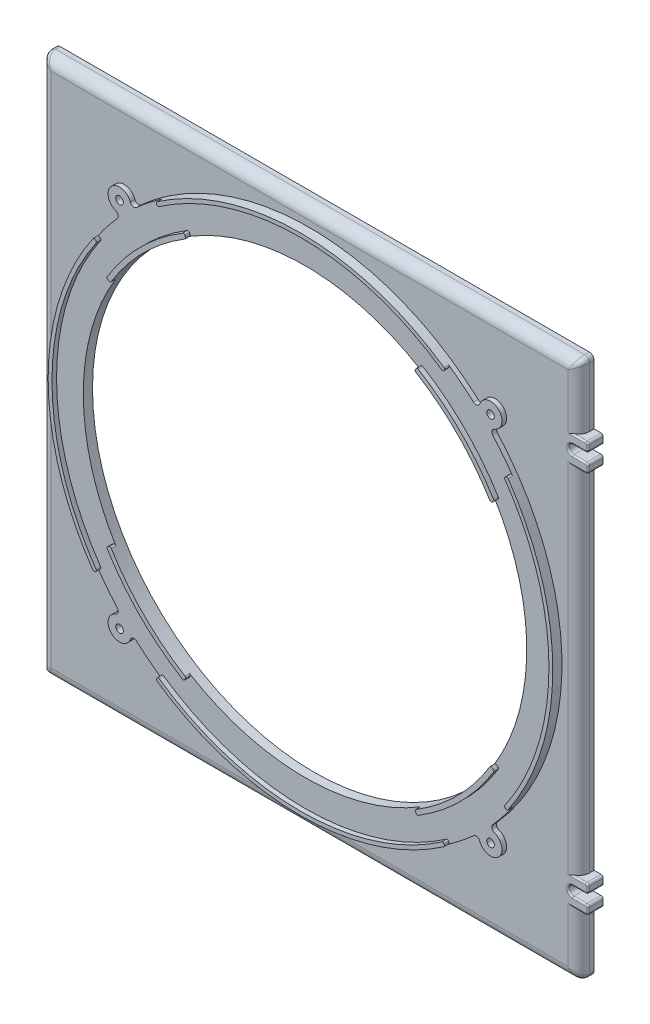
SolidWorks part; units mm, degrees
ref_plane "Alzado" through (0, 0, 0) normal (0, 0, 1) x (1, 0, 0)
ref_plane "Planta" through (0, 0, 0) normal (0, 1, 0) x (1, 0, 0)
ref_plane "Vista lateral" through (0, 0, 0) normal (1, 0, 0) x (0, 0, -1)
sketch "Croquis1" plane through (0, 0, 0) normal (0, 0, 1) x (1, 0, 0)
  line L1 (-170.2, -120.4149) -> (-170.1753, -120.4149)
  line L2 (-176, -109) -> (-177, -109)
  line L3 (-177, -109) -> (-177, -121)
  line L4 (-177, -121) -> (-170.2, -121)
  line L5 (-170.2, -121) -> (-170.2, -141)
  line L6 (-170.2, -141) -> (-176, -141)
  line L7 (-176, -141) -> (-176, -173)
  line L8 (-173, -176) -> (173, -176)
  line L9 (176, -173) -> (176, -134)
  line L10 (176, -134) -> (180.5, -134)
  line L11 (182, -132.5) -> (182, -129.5)
  line L12 (180.5, -128) -> (172, -128)
  line L13 (172, -122) -> (180.5, -122)
  line L14 (182, -120.5) -> (182, -117.5)
  line L15 (180.5, -116) -> (176, -116)
  line L16 (176, -116) -> (176, 116)
  line L17 (176, 116) -> (180.5, 116)
  line L18 (182, 117.5) -> (182, 120.5)
  line L19 (180.5, 122) -> (172, 122)
  line L20 (172, 128) -> (180.5, 128)
  line L21 (182, 129.5) -> (182, 132.5)
  line L22 (180.5, 134) -> (176, 134)
  line L23 (176, 134) -> (176, 173)
  line L24 (173, 176) -> (-173, 176)
  line L25 (-176, 173) -> (-176, 142)
  line L26 (-175, 141) -> (-171.2, 141)
  line L27 (-170.2, 140) -> (-170.2, 122)
  line L28 (-171.2, 121) -> (-177, 121)
  line L29 (-177, 121) -> (-177, 109)
  line L30 (-177, 109) -> (-176, 109)
  line L31 (-176, 109) -> (-176, -109)
  line L33 (-170.1513, -141.4184) -> (-170.2, -141.4184)
  line L41 (-170.2, 141.4184) -> (-170.1513, 141.4184)
  line L43 (-170.1753, 120.4149) -> (-170.2, 120.4149)
  arc A0 (-176, -173) -> (-173, -176) centre (-173, -173) ccw
  arc A1 (173, -176) -> (176, -173) centre (173, -173) ccw
  arc A2 (180.5, -134) -> (182, -132.5) centre (180.5, -132.5) ccw
  arc A3 (182, -129.5) -> (180.5, -128) centre (180.5, -129.5) ccw
  arc A4 (172, -122) -> (172, -128) centre (172, -125) ccw
  arc A5 (180.5, -122) -> (182, -120.5) centre (180.5, -120.5) ccw
  arc A6 (182, -117.5) -> (180.5, -116) centre (180.5, -117.5) ccw
  arc A7 (180.5, 116) -> (182, 117.5) centre (180.5, 117.5) ccw
  arc A8 (182, 120.5) -> (180.5, 122) centre (180.5, 120.5) ccw
  arc A9 (172, 128) -> (172, 122) centre (172, 125) ccw
  arc A10 (180.5, 128) -> (182, 129.5) centre (180.5, 129.5) ccw
  arc A11 (182, 132.5) -> (180.5, 134) centre (180.5, 132.5) ccw
  arc A12 (176, 173) -> (173, 176) centre (173, 173) ccw
  arc A13 (-173, 176) -> (-176, 173) centre (-173, 173) ccw
  arc A14 (-176, 142) -> (-175, 141) centre (-175, 142) ccw
  arc A15 (-170.2, 140) -> (-171.2, 141) centre (-171.2, 140) ccw
  arc A16 (-171.2, 121) -> (-170.2, 122) centre (-171.2, 122) ccw
extrude "Saliente-Extruir1" add sketch "Croquis1" along normal blind 10
fillet "Redondeo1" radius 1 3 edges at (-176, -141, 5) (-170.2, -141, 5) (-170.2, -121, 5)
sketch "Croquis3" plane through (0, 0, 0) normal (0, 0, -1) x (-1, 0, 0)
  line L0 (-166, 113.4674) -> (-166, -113.4674)
  line L1 (-166, 166) -> (166, 166)
  line L2 (174, -173) -> (174, -143)
  line L3 (174, -143) -> (171.2, -143)
  line L4 (168.2, -140) -> (168.2, -122)
  line L5 (-166, 166) -> (-166, 136.5326)
  line L6 (171.2, -119) -> (174, -119)
  line L7 (-166, -166) -> (166, -166)
  line L8 (166, 166) -> (166, 149.6933)
  line L9 (171.2, -119) -> (175, -119) construction
  line L10 (175, 119) -> (171.2, 119) construction
  line L11 (174, -119) -> (174, 119)
  line L12 (160.2, 122) -> (160.2, 140)
  line L13 (-174, 173) -> (-174, 132) construction
  line L14 (-174, 118) -> (-174, -118) construction
  line L15 (166, 112.3067) -> (166, -112.3067)
  line L16 (-180, 130) -> (-172, 130) construction
  line L17 (-172, 120) -> (-180, 120) construction
  line L18 (174, 119) -> (171.2, 119)
  line L19 (168.2, 122) -> (168.2, 140)
  line L20 (171.2, 143) -> (174, 143)
  line L21 (174, 143) -> (174, 173)
  line L22 (173, 174) -> (-173, 174)
  line L23 (-174, 173) -> (-174, 130)
  line L24 (-166, -136.5326) -> (-166, -166)
  line L25 (-174, -132) -> (-174, -173) construction
  line L26 (-180, -120) -> (-172, -120) construction
  line L27 (-174, 130) -> (-172, 130)
  line L28 (-172, 120) -> (-174, 120)
  line L29 (-172, -130) -> (-180, -130) construction
  line L30 (174, -111) -> (174, 111) construction
  line L31 (-174, 120) -> (-174, -120)
  line L32 (160.2, -140) -> (160.2, -122)
  line L33 (166, -149.6933) -> (166, -166)
  line L34 (-174, -120) -> (-172, -120)
  line L35 (-172, -130) -> (-174, -130)
  line L38 (-174, -130) -> (-174, -173)
  line L39 (-173, -174) -> (173, -174)
  line L40 (176, -173) -> (176, -142)
  line L41 (175, -141) -> (171.2, -141)
  line L42 (170.2, -140) -> (170.2, -122)
  line L43 (171.2, -121) -> (177, -121)
  line L44 (177, -121) -> (177, -109)
  line L45 (177, -109) -> (176, -109)
  line L46 (176, -109) -> (176, 109)
  line L47 (176, 109) -> (177, 109)
  line L48 (177, 109) -> (177, 121)
  line L49 (177, 121) -> (171.2, 121)
  line L50 (170.2, 122) -> (170.2, 140)
  line L51 (171.2, 141) -> (175, 141)
  line L52 (176, 142) -> (176, 173)
  line L53 (173, 176) -> (-173, 176)
  line L54 (-176, 173) -> (-176, 134)
  line L55 (-176, 134) -> (-180.5, 134)
  line L56 (-182, 132.5) -> (-182, 129.5)
  line L57 (-180.5, 128) -> (-172, 128)
  line L58 (-172, 122) -> (-180.5, 122)
  line L59 (-182, 120.5) -> (-182, 117.5)
  line L60 (-180.5, 116) -> (-176, 116)
  line L61 (-176, 116) -> (-176, -116)
  line L62 (-176, -116) -> (-180.5, -116)
  line L63 (-182, -117.5) -> (-182, -120.5)
  line L64 (-180.5, -122) -> (-172, -122)
  line L65 (-172, -128) -> (-180.5, -128)
  line L66 (-182, -129.5) -> (-182, -132.5)
  line L67 (-180.5, -134) -> (-176, -134)
  line L68 (-176, -134) -> (-176, -173)
  line L69 (-173, -176) -> (173, -176)
  line L98 (-176, -134) -> (-176, -173)
  line L100 (173, 176) -> (-173, 176) construction
  line L101 (-176, 173) -> (-176, 134) construction
  line L102 (-176, 134) -> (-180.5, 134) construction
  line L103 (-182, 132.5) -> (-182, 129.5) construction
  line L104 (-180.5, 128) -> (-172, 128) construction
  line L105 (-172, 122) -> (-180.5, 122) construction
  line L106 (-182, 120.5) -> (-182, 117.5) construction
  line L107 (-180.5, 116) -> (-176, 116) construction
  line L108 (-176, 116) -> (-176, -116) construction
  line L109 (-176, -116) -> (-180.5, -116) construction
  line L110 (-182, -117.5) -> (-182, -120.5) construction
  line L111 (-180.5, -122) -> (-172, -122) construction
  line L112 (-172, -128) -> (-180.5, -128) construction
  line L113 (-182, -129.5) -> (-182, -132.5) construction
  line L114 (-180.5, -134) -> (-176, -134) construction
  line L115 (-173, -176) -> (173, -176) construction
  line L116 (176, -173) -> (176, -142) construction
  line L117 (175, -141) -> (171.2, -141) construction
  line L118 (170.2, -140) -> (170.2, -122) construction
  line L119 (171.2, -121) -> (177, -121) construction
  line L120 (177, -121) -> (177, -109) construction
  line L121 (177, -109) -> (176, -109) construction
  line L122 (176, -109) -> (176, 109) construction
  line L123 (176, 109) -> (177, 109) construction
  line L124 (177, 109) -> (177, 121) construction
  line L125 (177, 121) -> (171.2, 121) construction
  line L126 (170.2, 122) -> (170.2, 140) construction
  line L127 (171.2, 141) -> (175, 141) construction
  line L128 (176, 142) -> (176, 173) construction
  line L129 (-180, 132) -> (-180, 130) construction
  line L130 (-180, 120) -> (-180, 118) construction
  line L131 (-174, 132) -> (-180, 132) construction
  line L132 (-180, 118) -> (-174, 118) construction
  line L133 (-174, -118) -> (-180, -118) construction
  line L134 (-180, -132) -> (-174, -132) construction
  line L135 (-180, -118) -> (-180, -120) construction
  line L136 (-180, -130) -> (-180, -132) construction
  line L137 (175, -111) -> (174, -111) construction
  line L138 (175, -119) -> (175, -111) construction
  line L139 (175, 111) -> (175, 119) construction
  line L140 (174, 111) -> (175, 111) construction
  arc A0 (-166, 113.4674) -> (-166, 136.5326) centre (-172, 125) ccw
  arc A1 (-172, 112) -> (-172, 138) centre (-172, 125) ccw construction
  arc A2 (174, -143) -> (174, -143) centre (174, -143) ccw
  arc A3 (168.2, -140) -> (171.2, -143) centre (171.2, -140) ccw
  arc A4 (-166, -136.5326) -> (-166, -113.4674) centre (-172, -125) ccw
  arc A5 (-172, -138) -> (-172, -112) centre (-172, -125) ccw construction
  arc A6 (171.2, -119) -> (168.2, -122) centre (171.2, -122) ccw
  arc A7 (168.2, 122) -> (171.2, 119) centre (171.2, 122) ccw
  arc A8 (171.2, 143) -> (168.2, 140) centre (171.2, 140) ccw
  arc A9 (174, 143) -> (174, 143) centre (174, 143) ccw
  arc A10 (174, 173) -> (173, 174) centre (173, 173) ccw
  arc A11 (-173, 174) -> (-174, 173) centre (-173, 173) ccw
  arc A12 (166, 149.6933) -> (160.2, 140) centre (171.2, 140) ccw
  arc A13 (160.2, 122) -> (166, 112.3067) centre (171.2, 122) ccw
  arc A14 (171.2, 151) -> (160.2, 140) centre (171.2, 140) ccw construction
  arc A15 (-172, 120) -> (-172, 130) centre (-172, 125) ccw
  arc A16 (160.2, 122) -> (171.2, 111) centre (171.2, 122) ccw construction
  arc A17 (166, -112.3067) -> (160.2, -122) centre (171.2, -122) ccw
  arc A18 (160.2, -140) -> (166, -149.6933) centre (171.2, -140) ccw
  arc A19 (171.2, -111) -> (160.2, -122) centre (171.2, -122) ccw construction
  arc A20 (160.2, -140) -> (171.2, -151) centre (171.2, -140) ccw construction
  arc A21 (-172, -130) -> (-172, -120) centre (-172, -125) ccw
  arc A24 (-174, -173) -> (-173, -174) centre (-173, -173) ccw
  arc A25 (173, -174) -> (174, -173) centre (173, -173) ccw
  arc A26 (176, -142) -> (175, -141) centre (175, -142) ccw
  arc A27 (170.2, -140) -> (171.2, -141) centre (171.2, -140) ccw
  arc A28 (171.2, -121) -> (170.2, -122) centre (171.2, -122) ccw
  arc A29 (170.2, 122) -> (171.2, 121) centre (171.2, 122) ccw
  arc A30 (171.2, 141) -> (170.2, 140) centre (171.2, 140) ccw
  arc A31 (175, 141) -> (176, 142) centre (175, 142) ccw
  arc A32 (176, 173) -> (173, 176) centre (173, 173) ccw
  arc A33 (-173, 176) -> (-176, 173) centre (-173, 173) ccw
  arc A34 (-180.5, 134) -> (-182, 132.5) centre (-180.5, 132.5) ccw
  arc A35 (-182, 129.5) -> (-180.5, 128) centre (-180.5, 129.5) ccw
  arc A36 (-172, 122) -> (-172, 128) centre (-172, 125) ccw
  arc A37 (-180.5, 122) -> (-182, 120.5) centre (-180.5, 120.5) ccw
  arc A38 (-182, 117.5) -> (-180.5, 116) centre (-180.5, 117.5) ccw
  arc A39 (-180.5, -116) -> (-182, -117.5) centre (-180.5, -117.5) ccw
  arc A40 (-182, -120.5) -> (-180.5, -122) centre (-180.5, -120.5) ccw
  arc A41 (-172, -128) -> (-172, -122) centre (-172, -125) ccw
  arc A42 (-180.5, -128) -> (-182, -129.5) centre (-180.5, -129.5) ccw
  arc A43 (-182, -132.5) -> (-180.5, -134) centre (-180.5, -132.5) ccw
  arc A44 (-176, -173) -> (-173, -176) centre (-173, -173) ccw
  arc A45 (173, -176) -> (176, -173) centre (173, -173) ccw
  arc A66 (-173, 176) -> (-176, 173) centre (-173, 173) ccw construction
  arc A67 (-180.5, 134) -> (-182, 132.5) centre (-180.5, 132.5) ccw construction
  arc A68 (-182, 129.5) -> (-180.5, 128) centre (-180.5, 129.5) ccw construction
  arc A69 (-172, 122) -> (-172, 128) centre (-172, 125) ccw construction
  arc A70 (-180.5, 122) -> (-182, 120.5) centre (-180.5, 120.5) ccw construction
  arc A71 (-182, 117.5) -> (-180.5, 116) centre (-180.5, 117.5) ccw construction
  arc A72 (-180.5, -116) -> (-182, -117.5) centre (-180.5, -117.5) ccw construction
  arc A73 (-182, -120.5) -> (-180.5, -122) centre (-180.5, -120.5) ccw construction
  arc A74 (-172, -128) -> (-172, -122) centre (-172, -125) ccw construction
  arc A75 (-180.5, -128) -> (-182, -129.5) centre (-180.5, -129.5) ccw construction
  arc A76 (-182, -132.5) -> (-180.5, -134) centre (-180.5, -132.5) ccw construction
  arc A77 (-176, -173) -> (-173, -176) centre (-173, -173) ccw construction
  arc A78 (173, -176) -> (176, -173) centre (173, -173) ccw construction
  arc A79 (176, -142) -> (175, -141) centre (175, -142) ccw construction
  arc A80 (170.2, -140) -> (171.2, -141) centre (171.2, -140) ccw construction
  arc A81 (171.2, -121) -> (170.2, -122) centre (171.2, -122) ccw construction
  arc A82 (170.2, 122) -> (171.2, 121) centre (171.2, 122) ccw construction
  arc A83 (171.2, 141) -> (170.2, 140) centre (171.2, 140) ccw construction
  arc A84 (175, 141) -> (176, 142) centre (175, 142) ccw construction
  arc A85 (176, 173) -> (173, 176) centre (173, 173) ccw construction
  arc A86 (-180, 132) -> (-180, 132) centre (-180, 132) ccw construction
  arc A87 (-180, 130) -> (-180, 130) centre (-180, 130) ccw construction
  arc A88 (-180, 120) -> (-180, 120) centre (-180, 120) ccw construction
  arc A89 (-180, 118) -> (-180, 118) centre (-180, 118) ccw construction
  arc A90 (-180, -118) -> (-180, -118) centre (-180, -118) ccw construction
  arc A91 (-180, -120) -> (-180, -120) centre (-180, -120) ccw construction
  arc A92 (-180, -130) -> (-180, -130) centre (-180, -130) ccw construction
  arc A93 (-180, -132) -> (-180, -132) centre (-180, -132) ccw construction
  dimension "D1" = 0
  dimension "D4" = 8
  dimension "D2" = 2
  dimension "D3" = 8
  dimension "D5" = 8
  dimension "D6" = 8
  dimension "D7" = 8
  dimension "D8" = 8
  dimension "D9" = 8
  dimension "D10" = 8
extrude "Cortar-Extruir4" cut sketch "Croquis3" against normal blind 6 contours L39 A25 L2 L3 A3 L4 A6 L6 L11 L18 A7 L19 A8 L20 L21 A10 L22 A11 L23 L27 A15 L28 L31 L34 A21 L35 L38 A24 L32 A18 L33 L7 L24 A4 L0 A0 L5 L1 L8 A12 L12 A13 L15 A17
sketch "Croquis4" plane through (0, 0, 10) normal (0, 0, 1) x (1, 0, 0)
  line L0 (-171.2, 121) -> (-177, 121) construction
  line L1 (-176, 121) -> (-177, 121)
  line L2 (-176, 121) -> (-176, -121)
  line L3 (-176, -121) -> (-177, -121)
  line L4 (-177, 121) -> (-177, -121)
extrude "Cortar-Extruir5" cut sketch "Croquis4" against normal up to vertex
sketch "Croquis5" plane through (0, 0, 10) normal (0, 0, 1) x (1, 0, 0)
  line L1 (-176, 142) -> (-170.1799, 142)
  line L2 (-176, 142) -> (-176, -142)
  line L3 (-176, -142) -> (-170.1799, -142)
  line L4 (-170.1799, 142) -> (-170.1799, -142)
extrude "Saliente-Extruir2" add sketch "Croquis5" against normal up to vertex
ref_plane "Plano1" through (0, 141, 0) normal (0, 1, 0) x (-1, 0, 0)
sketch "Croquis6" plane through (0, 141, 0) normal (0, 1, 0) x (-1, 0, 0)
  line L0 (183, -6) -> (183, -14)
  line L1 (171, -14) -> (171, -6)
  line L2 (171, -6) -> (171, 0)
  line L3 (-173, 0) -> (173, 0) construction
  line L4 (171, 0) -> (177, 0)
  arc A0 (183, -6) -> (177, 0) centre (177, -6) ccw
  arc A1 (171, -14) -> (183, -14) centre (177, -14) ccw
  circle A2 centre (177, -14) radius 1.585
extrude "Saliente-Extruir3" add sketch "Croquis6" against normal blind 20 separate body
pattern_linear "MatrizL3" count 2 spacing 262 along (0, -1, 0) of "Saliente-Extruir3"
fillet "Redondeo4" radius 3 4 edges at (-166, -166, 3) (-166, 166, 3) (166, 166, 3) (166, -166, 3)
fillet "Redondeo5" radius 7 10 edges at (176, 153.5, 10) (175.1213, 175.1213, 10) (176, -153.5, 10) (175.1213, -175.1213, 10) (0, -176, 10) (-175.1213, -175.1213, 10) (-176, 0, 10) (-175.1213, 175.1213, 10) (176, 0, 10) (0, 176, 10)
fillet "Redondeo6" radius 1 22 edges at (174.75, -134, 10) (181.5607, -133.5607, 10) (182, -131, 10) (181.5607, -128.4393, 10) (176.25, -128, 10) (169, -125, 10) (176.25, -122, 10) (181.5607, -121.5607, 10) (182, -119, 10) (181.5607, -116.4393, 10) (174.75, 116, 10) (181.5607, 116.4393, 10) (182, 119, 10) (181.5607, 121.5607, 10) (176.25, 122, 10) (169, 125, 10) (176.25, 128, 10) (181.5607, 128.4393, 10) (182, 131, 10) (181.5607, 133.5607, 10) (174.75, -116, 10) (174.75, 134, 10)
sketch "Croquis7" plane through (0, 0, 0) normal (0, 0, -1) x (-1, 0, 0)
  circle A0 centre (0, 0) radius 145
  dimension "D1" = 290
extrude "Cortar-Extruir6" cut sketch "Croquis7" against normal through all
sketch "Croquis8" plane through (0, 0, 0) normal (0, 0, -1) x (-1, 0, 0)
  circle A0 centre (0, 0) radius 160
  dimension "D1" = 320
extrude "Cortar-Extruir7" cut sketch "Croquis8" against normal blind 7
sketch "Croquis9" plane through (0, 0, 0) normal (0, 0, -1) x (-1, 0, 0)
  line L0 (-163, -164) -> (-36.2767, -164)
  line L1 (164, -163) -> (164, -150.824)
  line L2 (158.2, -140) -> (158.2, -122)
  line L3 (164, -111.176) -> (164, -36.2767)
  line L4 (158.2, 122) -> (158.2, 140)
  line L5 (164, 150.824) -> (164, 163)
  line L6 (163, 164) -> (36.2767, 164)
  line L7 (-164, 163) -> (-164, 137.6886)
  line L8 (-164, 112.3114) -> (-164, 36.2767)
  line L9 (-164, -137.6886) -> (-164, -163)
  line L10 (-36.2767, 164) -> (-163, 164)
  line L11 (164, 36.2767) -> (164, 111.176)
  line L12 (-164, -36.2767) -> (-164, -112.3114)
  line L13 (36.2767, -164) -> (163, -164)
  arc A0 (161.036, 35.9499) -> (35.9499, 161.036) centre (0, 0) ccw
  arc A1 (163, -164) -> (164, -163) centre (163, -163) ccw
  arc A2 (158.2, -140) -> (164, -150.824) centre (171.2, -140) ccw
  arc A3 (164, -111.176) -> (158.2, -122) centre (171.2, -122) ccw
  arc A4 (158.2, 122) -> (164, 111.176) centre (171.2, 122) ccw
  arc A5 (164, 150.824) -> (158.2, 140) centre (171.2, 140) ccw
  arc A6 (164, 163) -> (163, 164) centre (163, 163) ccw
  arc A7 (-163, 164) -> (-164, 163) centre (-163, 163) ccw
  arc A8 (-164, 112.3114) -> (-164, 137.6886) centre (-172, 125) ccw
  arc A9 (-164, -137.6886) -> (-164, -112.3114) centre (-172, -125) ccw
  arc A10 (-35.9499, 161.036) -> (-161.036, 35.9499) centre (0, 0) ccw
  arc A11 (-161.036, -35.9499) -> (-35.9499, -161.036) centre (0, 0) ccw
  arc A12 (35.9499, -161.036) -> (161.036, -35.9499) centre (0, 0) ccw
  arc A13 (-36.2767, -164) -> (-35.9499, -161.036) centre (-36.2767, -162.5) ccw
  arc A14 (36.2767, -164) -> (35.9499, -161.036) centre (36.2767, -162.5) cw
  arc A15 (164, -36.2767) -> (161.036, -35.9499) centre (162.5, -36.2767) ccw
  arc A16 (164, 36.2767) -> (161.036, 35.9499) centre (162.5, 36.2767) cw
  arc A17 (-164, -36.2767) -> (-161.036, -35.9499) centre (-162.5, -36.2767) cw
  arc A18 (-164, 36.2767) -> (-161.036, 35.9499) centre (-162.5, 36.2767) ccw
  arc A19 (-35.9499, 161.036) -> (-36.2767, 164) centre (-36.2767, 162.5) ccw
  arc A20 (35.9499, 161.036) -> (36.2767, 164) centre (36.2767, 162.5) cw
  arc A30 (-164, -163) -> (-163, -164) centre (-163, -163) ccw
  point P20 (18.1384, -164)
  point P27 (164, 18.1384)
  point P31 (-164, -18.1384)
  point P36 (-18.1384, 164)
  dimension "D1" = 1.5
extrude "Cortar-Extruir8" cut sketch "Croquis9" against normal blind 7
sketch "Croquis10" plane through (0, 0, 7) normal (0, 0, -1) x (-1, 0, 0)
  circle A0 centre (-109.1197, 117.0166) radius 3
  circle A1 centre (0, 0) radius 160 construction
  circle A3 centre (-117.0166, 109.1197) radius 3
  dimension "D1" = 6
extrude "Saliente-Extruir4" add sketch "Croquis10" along normal blind 4.5
pattern_circular "MatrizC1" count 2 every 15 about axis through (0, 0, 0) along (0, 0, 1) of "Saliente-Extruir4"
pattern_circular "MatrizC2" count 2 every 15 about axis through (0, 0, 0) along (0, 0, 1) of "Saliente-Extruir4"
pattern_circular "MatrizC3" count 4 over 360 about axis through (0, 0, 0) along (0, 0, 1) of "Saliente-Extruir4", "MatrizC1", "MatrizC2"
sketch "Croquis11" plane through (0, 0, 0) normal (0, 0, -1) x (-1, 0, 0)
  line L0 (-161.036, 35.9499) -> (-157.6685, 38.9091)
  line L1 (-35.9499, 161.036) -> (-38.6701, 157.7272)
  arc A0 (-114.8509, 123.9988) -> (-123.9988, 114.8509) centre (-121.3166, 121.3166) ccw
  arc A1 (-122.9136, 110.0784) -> (-161.036, 35.9499) centre (0, 0) ccw
  arc A2 (-35.9499, 161.036) -> (-110.0784, 122.9136) centre (0, 0) ccw
  arc A3 (-122.9136, 110.0784) -> (-123.9988, 114.8509) centre (-125.1483, 112.0798) ccw
  arc A4 (-110.0784, 122.9136) -> (-114.8509, 123.9988) centre (-112.0798, 125.1483) cw
  arc A5 (-38.6701, 157.7272) -> (-157.6685, 38.9091) centre (0, 0) ccw
  circle A6 centre (-121.3166, 121.3166) radius 3.3834
  dimension "D1" = 14
  dimension "D2" = 3
extrude "Saliente-Extruir5" add sketch "Croquis11" against normal up to vertex
pattern_circular "MatrizC5" count 4 over 360 about axis through (0, 0, 0) along (0, 0, 1) of "Saliente-Extruir5"
sketch "Croquis12" plane through (0, 0, 10) normal (0, 0, 1) x (1, 0, 0)
  circle A0 centre (0, 0) radius 165
  circle A1 centre (0, 0) radius 145
  dimension "D1" = 330
extrude "Saliente-Extruir6" add sketch "Croquis12" along normal blind 3
sketch "Croquis14" plane through (0, 0, 10) normal (0, 0, 1) x (1, 0, 0)
  circle A0 centre (121.3166, 121.3166) radius 7.5
  dimension "D2" = 15
extrude "Saliente-Extruir8" add sketch "Croquis14" along normal blind 3
fillet "Redondeo7" radius 2.5 2 edges at (119.1569, 114.1343, 11.5) (114.1343, 119.1569, 11.5)
pattern_circular "MatrizC6" count 4 over 360 about axis through (0, 0, 0) along (0, 0, 1) of "Saliente-Extruir8", "Redondeo7"
sketch "Croquis15" plane through (0, 0, 13) normal (0, 0, 1) x (1, 0, 0)
  circle A0 centre (-121.3166, 121.3166) radius 2.5
  dimension "D1" = 5
extrude "Cortar-Extruir9" cut sketch "Croquis15" against normal through all
pattern_circular "MatrizC7" count 4 over 360 about axis through (0, 0, 0) along (0, 0, 1) of "Cortar-Extruir9"
sketch "Croquis17" plane through (0, 0, 13) normal (0, 0, 1) x (1, 0, 0)
  line L0 (93.2062, 133.1122) -> (94.6401, 135.1601)
  line L2 (-93.2062, 133.1122) -> (-94.6401, 135.1601)
  arc A0 (93.2062, 133.1122) -> (-93.2062, 133.1122) centre (0, 0) ccw
  arc A1 (94.6401, 135.1601) -> (-94.6401, 135.1601) centre (0, 0) ccw
  dimension "D1" = 325
extrude "Saliente-Extruir9" add sketch "Croquis17" along normal blind 3
fillet "Redondeo8" radius 1 4 edges at (-93.2062, 133.1122, 14.5) (93.2062, 133.1122, 14.5)
pattern_circular "MatrizC8" count 4 over 360 about axis through (0, 0, 0) along (0, 0, 1) of "Saliente-Extruir9", "Redondeo8"
sketch "Croquis18" plane through (0, 0, 13) normal (0, 0, 1) x (1, 0, 0)
  line L1 (-74.6805, 124.2893) -> (-76.2256, 126.8608)
  line L2 (-124.2893, 74.6805) -> (-126.8608, 76.2256)
  arc A0 (-76.2256, 126.8608) -> (-126.8608, 76.2256) centre (0, 0) ccw
  arc A1 (-74.6805, 124.2893) -> (-124.2893, 74.6805) centre (0, 0) ccw
  dimension "D1" = 290
  dimension "D2" = 296
extrude "Saliente-Extruir10" add sketch "Croquis18" along normal up to vertex
fillet "Redondeo9" radius 1 4 edges at (-126.8608, 76.2256, 14.5) (-124.2893, 74.6805, 14.5) (-76.2256, 126.8608, 14.5) (-74.6805, 124.2893, 14.5)
pattern_circular "MatrizC9" count 4 over 360 about axis through (0, 0, 0) along (0, 0, 1) of "Saliente-Extruir10", "Redondeo9"
